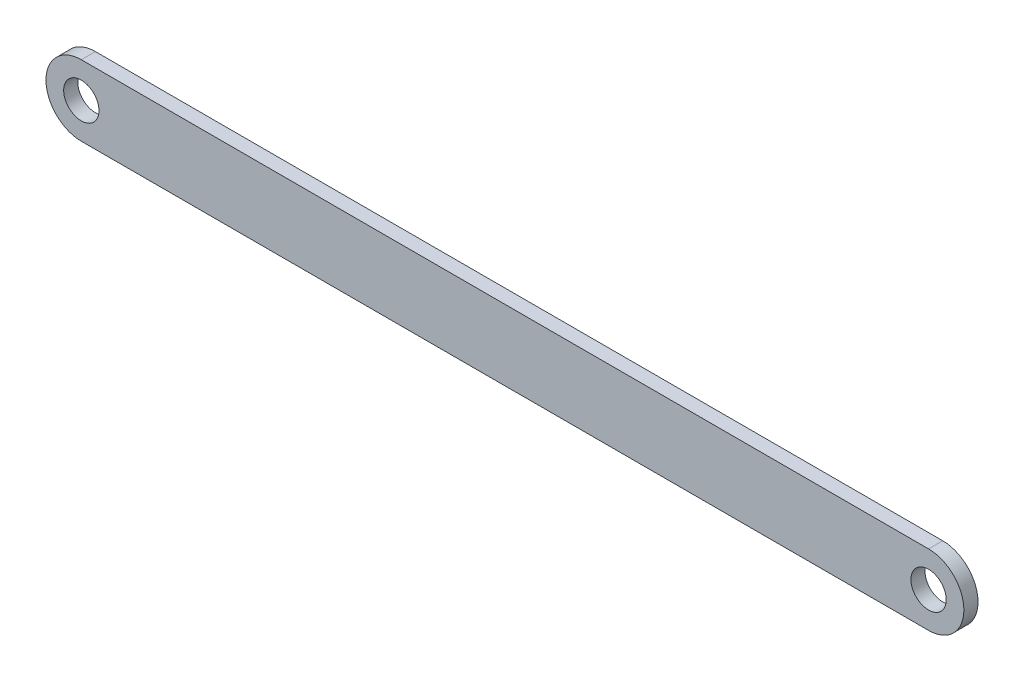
SolidWorks part; units mm, degrees
ref_plane "Front Plane" through (0, 0, 0) normal (0, 0, 1) x (1, 0, 0)
ref_plane "Top Plane" through (0, 0, 0) normal (0, 1, 0) x (1, 0, 0)
ref_plane "Right Plane" through (0, 0, 0) normal (1, 0, 0) x (0, 0, -1)
sketch "Sketch1" plane through (0, 0, 0) normal (0, 0, 1) x (1, 0, 0)
  line L0 (-60, 0) -> (60, 0) construction
  line L1 (-60, 5) -> (60, 5)
  line L2 (-60, -5) -> (60, -5)
  arc A0 (-60, 5) -> (-60, -5) centre (-60, 0) ccw
  arc A1 (60, -5) -> (60, 5) centre (60, 0) ccw
  circle A2 centre (-60, 0) radius 2.5
  circle A3 centre (60, 0) radius 2.5
  point P2 (0, 0)
  dimension "D3" = 5
  dimension "D4" = 5
  dimension "D1" = 120
  dimension "D2" = 10
extrude "Boss-Extrude1" add sketch "Sketch1" along normal mid plane 2
